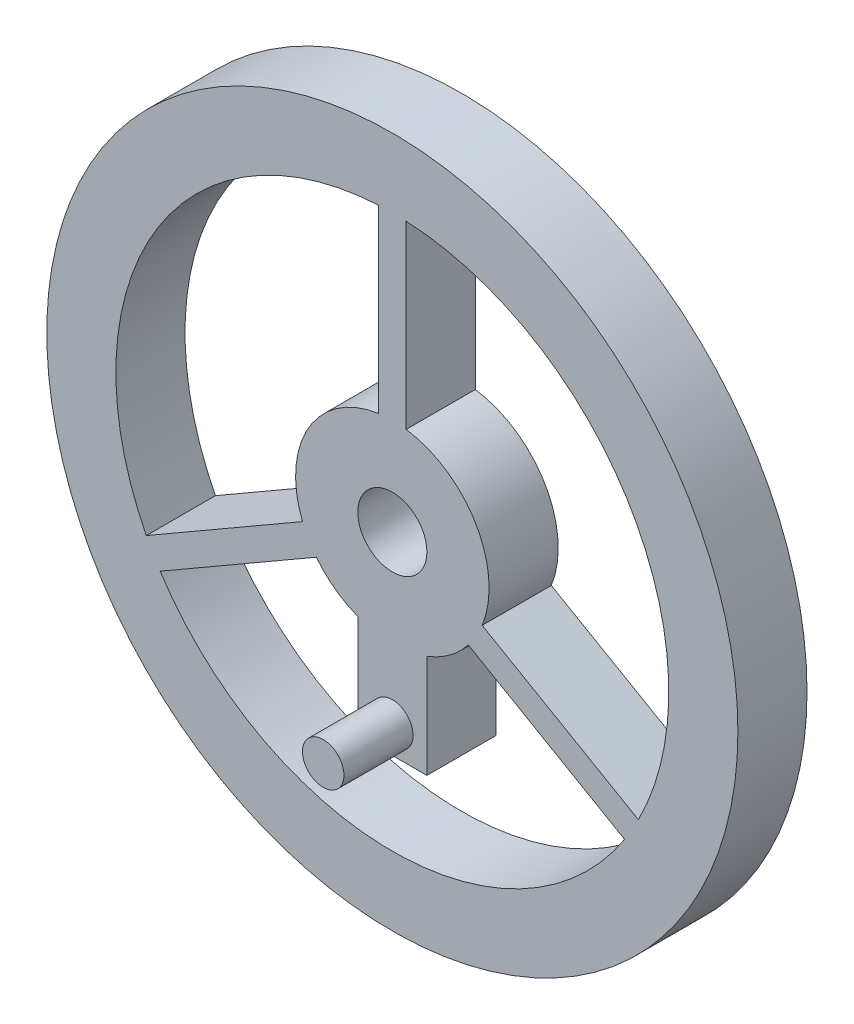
SolidWorks part; units mm, degrees
ref_plane "Front Plane" through (0, 0, 0) normal (0, 0, 1) x (1, 0, 0)
ref_plane "Top Plane" through (0, 0, 0) normal (0, 1, 0) x (1, 0, 0)
ref_plane "Right Plane" through (0, 0, 0) normal (1, 0, 0) x (0, 0, -1)
sketch "Sketch1" plane through (0, 0, 0) normal (0, 0, 1) x (1, 0, 0)
sketch_block_instance "Block-Wheel-1"
sketch_block "Block-Wheel" parameters "D1"=50, "D13"=3, "D14"=20, "D15"=7, "D16"=7.701, "D2"=120, "D3"=120, "D4"=2, "D5"=1, "D6"=2, "D7"=1, "D8"=2, "D9"=1, "D10"=5, "D11"=12, "D12"=2
extrude "Boss-Extrude1" add sketch "Sketch1" against normal blind 5
extrude "Boss-Extrude2" add sketch "Sketch1<3>" along normal blind 5 separate body
sketch "Sketch1<3>"
